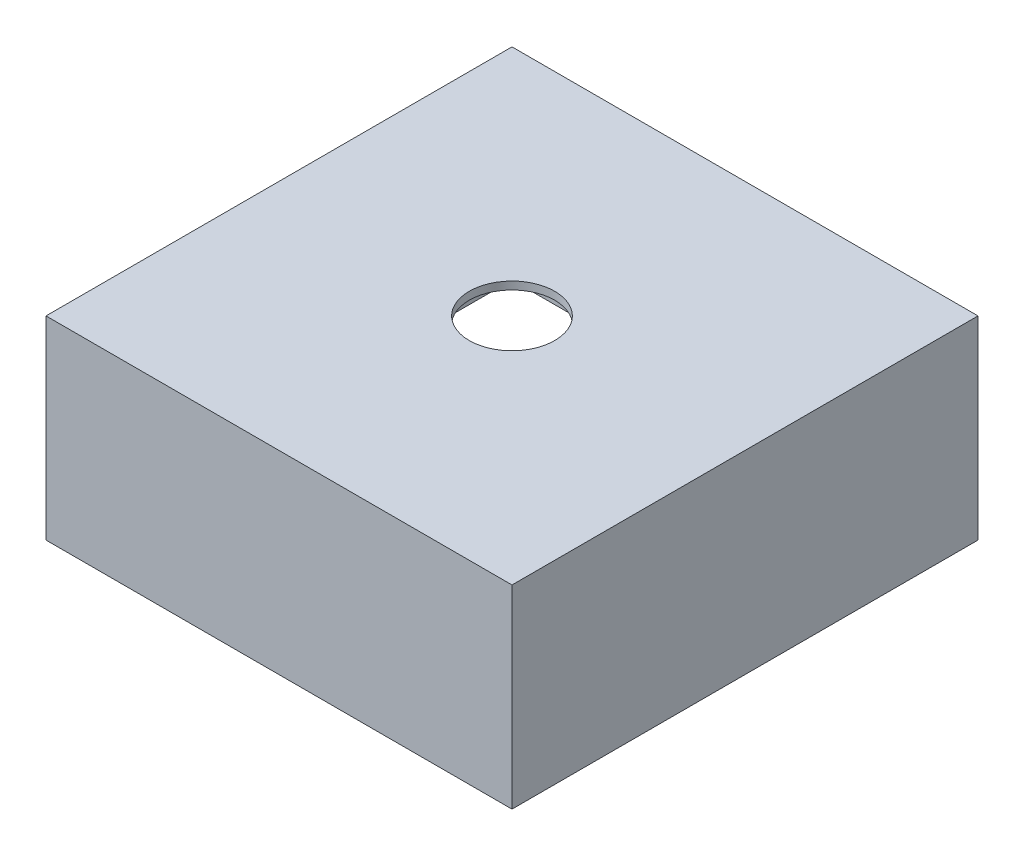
SolidWorks part; units mm, degrees
ref_plane "Front" through (0, 0, 0) normal (0, 0, 1) x (1, 0, 0)
ref_plane "Top" through (0, 0, 0) normal (0, 1, 0) x (1, 0, 0)
ref_plane "Right" through (0, 0, 0) normal (1, 0, 0) x (0, 0, -1)
sketch "Sketch1" plane through (0, 0, 0) normal (0, 1, 0) x (1, 0, 0)
  line L1 (76.2, 76.2) -> (-76.2, 76.2)
  line L2 (76.2, 76.2) -> (76.2, -76.2)
  line L3 (76.2, -76.2) -> (-76.2, -76.2)
  line L4 (-76.2, 76.2) -> (-76.2, -76.2)
  line L5 (76.2, 76.2) -> (-76.2, -76.2) construction
  line L6 (76.2, -76.2) -> (-76.2, 76.2) construction
  point P1 (0, 0)
  dimension "D1" = 152.4
  dimension "D2" = 152.4
extrude "Boss-Extrude1" add sketch "Sketch1" along normal blind 63.5
shell "Shell1" thickness 2.54
sketch "Sketch2" plane through (0, 63.5, 0) normal (0, 1, 0) x (1, 0, 0)
  circle A0 centre (0, 0) radius 13.97
  dimension "D1" = 27.94
extrude "Cut-Extrude1" cut sketch "Sketch2" against normal up to surface (2.54 mm away)
